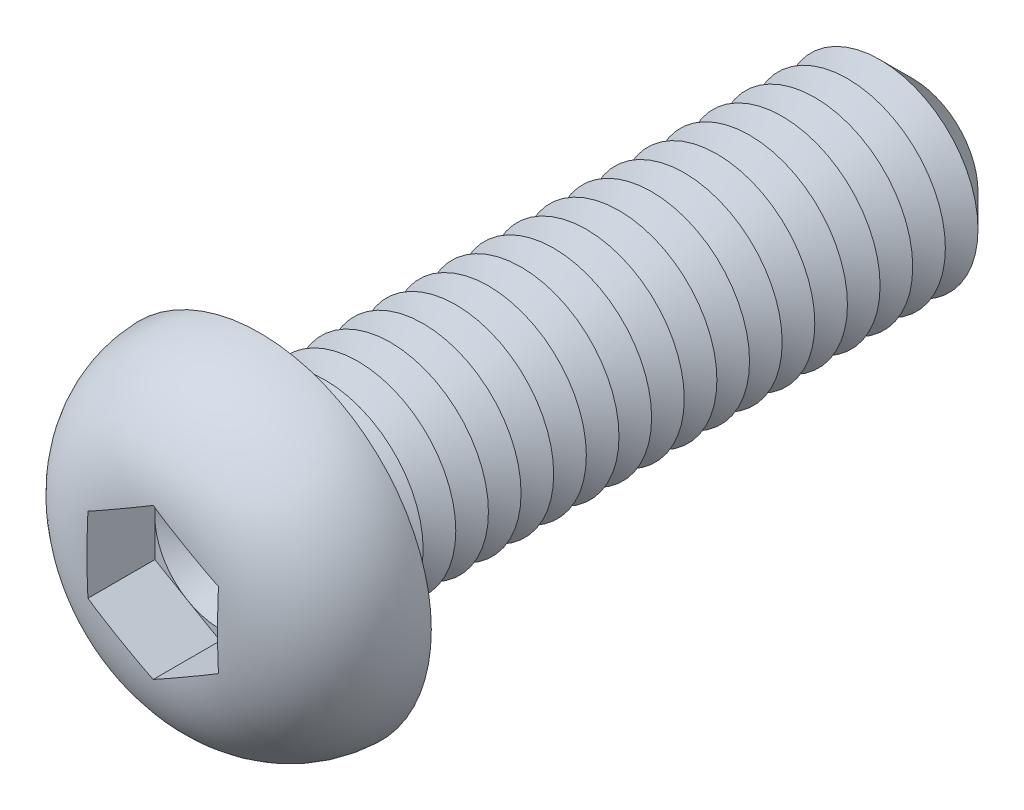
SolidWorks part; units mm, degrees
ref_plane "Front Plane" through (0, 0, 0) normal (0, 0, 1) x (1, 0, 0)
ref_plane "Top Plane" through (0, 0, 0) normal (0, 1, 0) x (1, 0, 0)
ref_plane "Right Plane" through (0, 0, 0) normal (1, 0, 0) x (0, 0, -1)
sketch "Sketch1" plane through (0, 0, 0) normal (1, 0, 0) x (0, 0, -1)
  line L0 (-47.9342, 0) -> (60.3146, 0) construction
sketch "Sketch2" plane through (0, 0, 0) normal (1, 0, 0) x (0, 0, -1)
  line L0 (0, 0) -> (-3.3, 0)
  line L1 (-47.9342, 0) -> (60.3146, 0) construction
  line L2 (-3.3, 0) -> (-3.3, 1.8515)
  line L3 (0, 5.25) -> (0, 0)
  arc A0 (-3.3, 1.8515) -> (0, 5.25) centre (0.1, 1.8515) cw
  dimension "D1" = 3.4
  dimension "D2" = 3.3
  dimension "D3" = 5.25
revolve "Revolve1" add sketch "Sketch2" angle 360 about L0
sketch "Sketch3" plane through (0, 0, 3.3) normal (0, 0, 1) x (1, 0, 0)
  line L1 (0, 2.3094) -> (-2, 1.1547)
  line L2 (-2, 1.1547) -> (-2, -1.1547)
  line L3 (-2, -1.1547) -> (0, -2.3094)
  line L4 (0, -2.3094) -> (2, -1.1547)
  line L5 (2, -1.1547) -> (2, 1.1547)
  line L6 (2, 1.1547) -> (0, 2.3094)
  circle A0 centre (0, 0) radius 2 construction
  dimension "D1" = 4
extrude "Cut-Extrude1" cut sketch "Sketch3" against normal blind 2.08
sketch "Sketch4" plane through (0, 0, 0) normal (0, 0, -1) x (-1, 0, 0)
  circle A0 centre (0, 0) radius 3
  dimension "D1" = 6
extrude "Boss-Extrude1" add sketch "Sketch4" along normal blind 20
chamfer "Chamfer1" distance 1 angle 45 1 edges at (-3, 0, -20)
sketch "Sketch5" plane through (0, 0, 0) normal (1, 0, 0) x (0, 0, -1)
  line L0 (1, 3) -> (2, 3)
  line L1 (19, 3) -> (0, 3) construction
  line L2 (2, 3) -> (1.5, 2.134)
  line L3 (1.5, 2.134) -> (1, 3)
  line L4 (0, -5.25) -> (0, 5.25) construction
  line L5 (19, 3) -> (0, 3) construction
  dimension "D1" = 1
  dimension "D2" = 1
revolve "Cut-Revolve1" cut sketch "Sketch5" angle 360 about L0
pattern_linear "LPattern1" count 18 spacing 1 along (0, 0, -1) of "Cut-Revolve1"
fillet "Fillet2" radius 0.5 1 edges at (-3, 0, 0)
sketch "Sketch6" plane through (0, 0, 1.22) normal (0, 0, 1) x (1, 0, 0)
  line L0 (0, -2.3094) -> (2, -1.1547) construction
  circle A0 centre (0, 0) radius 2
extrude "Cut-Extrude2" cut sketch "Sketch6" against normal through all draft 60
